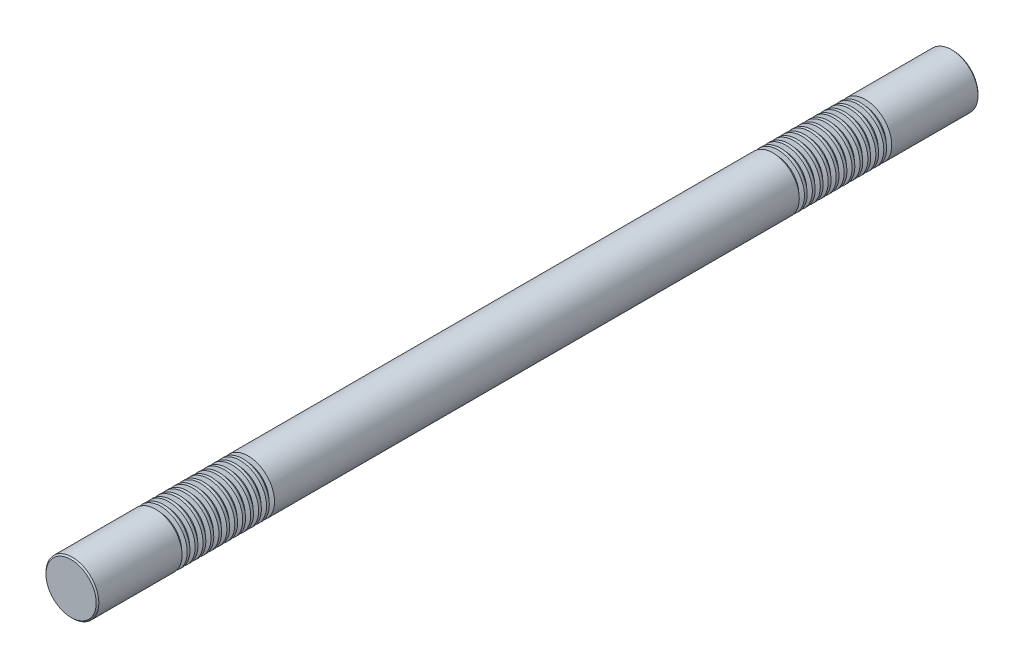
SolidWorks part; units mm, degrees
ref_plane "Front Plane" through (0, 0, 0) normal (0, 0, 1) x (1, 0, 0)
ref_plane "Top Plane" through (0, 0, 0) normal (0, 1, 0) x (1, 0, 0)
ref_plane "Right Plane" through (0, 0, 0) normal (1, 0, 0) x (0, 0, -1)
sketch "Sketch1" plane through (0, 0, 0) normal (0, 0, 1) x (1, 0, 0)
  circle A0 centre (0, 0) radius 30
  dimension "D1" = 60
extrude "Boss-Extrude1" add sketch "Sketch1" along normal mid plane 1000
chamfer "Chamfer1" distance 1.5 angle 45 2 edges at (30, 0, -500) (30, 0, 500)
sketch "Sketch2" plane through (0, 0, 0) normal (1, 0, 0) x (0, 0, -1)
  line L0 (400.6699, 30) -> (394.8301, 30)
  line L1 (498.5, 30) -> (-498.5, 30) construction
  line L2 (394.8301, 30) -> (396.1699, 25)
  line L3 (396.1699, 25) -> (399.3301, 25)
  line L4 (399.3301, 25) -> (400.6699, 30)
  line L5 (500, -28.5) -> (500, 28.5) construction
  point P4 (397.75, 30)
  point P7 (397.75, 25)
  point P8 (400, 27.5)
  point P9 (395.5, 27.5)
  dimension "D1" = 4.5
  dimension "D2" = 100
  dimension "D3" = 5
  dimension "D4" = 30
revolve "Cut-Revolve1" cut sketch "Sketch2" angle 360 about axis through (0, 0, 500) along (0, 0, -1)
pattern_linear "LPattern1" count 12 spacing 9 along (0, 0, 1) of "Cut-Revolve1"
pattern_linear "LPattern2" count 2 spacing 700 along (0, 0, 1) of "Cut-Revolve1", "LPattern1"
